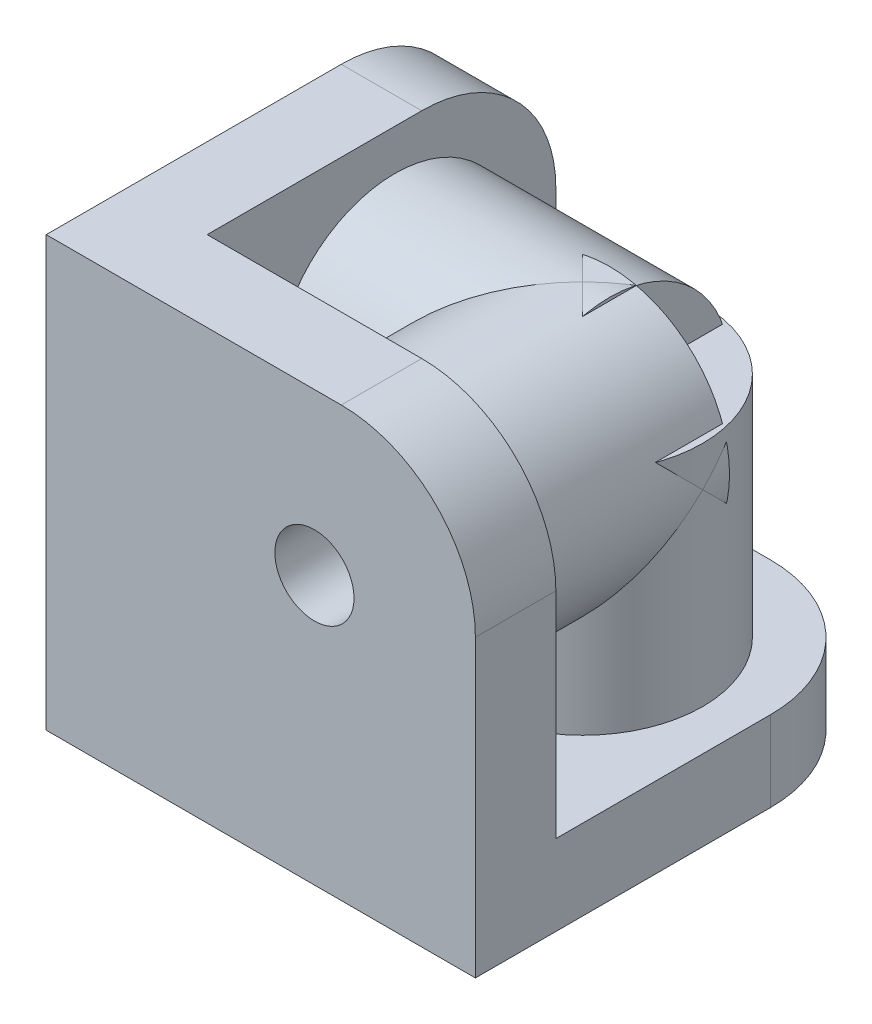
SolidWorks part; units mm, degrees
ref_plane "Plan de face" through (0, 0, 0) normal (0, 0, 1) x (1, 0, 0)
ref_plane "Plan de dessus" through (0, 0, 0) normal (0, 1, 0) x (1, 0, 0)
ref_plane "Plan de droite" through (0, 0, 0) normal (1, 0, 0) x (0, 0, -1)
sketch "Esquisse1" plane through (0, 0, 0) normal (0, 0, 1) x (1, 0, 0)
  line L0 (0, 0) -> (16, 16) construction
  line L1 (0, 0) -> (16, 0)
  line L2 (0, 0) -> (0, 16)
  line L3 (0, 16) -> (16, 16)
  line L4 (16, 0) -> (16, 16)
extrude "Boss.-Extru.1" add sketch "Esquisse1" against normal blind 16
sketch "Esquisse2" plane through (0, 0, 0) normal (0, -1, 0) x (-1, 0, 0)
  line L0 (0, 0) -> (-16, 16) construction
  line L1 (0, 0) -> (-16, 0) construction
  circle A0 centre (-10, 10) radius 1.475
  dimension "D1" = 2.95
  dimension "D2" = 10
extrude "Enlèv. mat.-Extru.1" cut sketch "Esquisse2" against normal blind 8.5
sketch "Esquisse3" plane through (0, 0, 0) normal (-1, 0, 0) x (0, 0, 1)
  line L0 (0, 0) -> (-16, 16) construction
  line L1 (-16, 0) -> (0, 0) construction
  circle A0 centre (-10, 10) radius 1.475
  dimension "D1" = 2.95
  dimension "D2" = 10
extrude "Enlèv. mat.-Extru.2" cut sketch "Esquisse3" against normal blind 8
sketch "Esquisse4" plane through (0, 0, 0) normal (0, 0, 1) x (1, 0, 0)
  line L0 (0, 0) -> (16, 16) construction
  line L1 (0, 16) -> (0, 0) construction
  circle A0 centre (10, 10) radius 1.475
  dimension "D1" = 2.95
  dimension "D2" = 10
extrude "Enlèv. mat.-Extru.3" cut sketch "Esquisse4" against normal blind 8
shell "Coque1" thickness 3
fillet "Congé1" radius 5 3 edges at (1.5, 16, -16) (16, 1.5, -16) (16, 16, -1.5)
equation "\"D2@Esquisse1\"=\"D1@Esquisse1\""
